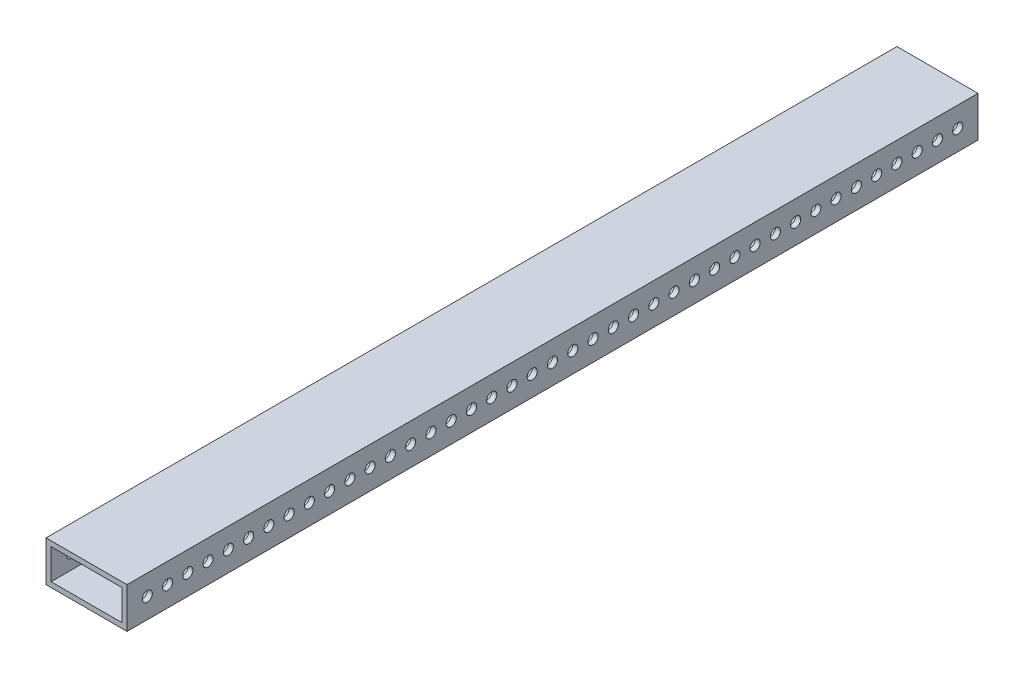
SolidWorks part; units mm, degrees
ref_plane "Front" through (0, 0, 0) normal (0, 0, 1) x (1, 0, 0)
ref_plane "Top" through (0, 0, 0) normal (0, 1, 0) x (1, 0, 0)
ref_plane "Right" through (0, 0, 0) normal (1, 0, 0) x (0, 0, -1)
sketch "Sketch1" plane through (0, 0, 0) normal (0, 0, 1) x (1, 0, 0)
  line L0 (-22.225, 9.525) -> (-22.225, 12.7) construction
  line L1 (25.4, -12.7) -> (-25.4, -12.7)
  line L2 (25.4, -12.7) -> (25.4, 12.7)
  line L3 (25.4, 12.7) -> (-25.4, 12.7)
  line L4 (-25.4, -12.7) -> (-25.4, 12.7)
  line L5 (25.4, -12.7) -> (-25.4, 12.7) construction
  line L6 (25.4, 12.7) -> (-25.4, -12.7) construction
  line L7 (22.225, -9.525) -> (-22.225, -9.525)
  line L8 (22.225, -9.525) -> (22.225, 9.525)
  line L9 (22.225, 9.525) -> (-22.225, 9.525)
  line L10 (-22.225, -9.525) -> (-22.225, 9.525)
  line L11 (22.225, -9.525) -> (-22.225, 9.525) construction
  line L12 (22.225, 9.525) -> (-22.225, -9.525) construction
  line L13 (-22.225, 9.525) -> (-25.4, 9.525) construction
  point P0 (0, 0)
  point P6 (0, 0)
  dimension "D1" = 25.4
  dimension "D2" = 50.8
  dimension "D3" = 3.175
extrude "Boss-Extrude1" add sketch "Sketch1" along normal mid plane 533.4
sketch "Sketch2" plane through (25.4, 0, 0) normal (1, 0, 0) x (0, 0, -1)
  line L0 (-266.7, -12.7) -> (-266.7, 12.7) construction
  circle A0 centre (-254, 0) radius 3.175
  dimension "D1" = 12.7
  dimension "D2" = 6.35
extrude "Cut-Extrude1" cut sketch "Sketch2" against normal through all
pattern_linear "LPattern1" count 41 spacing 12.7 along (0, 0, -1) of "Cut-Extrude1"
